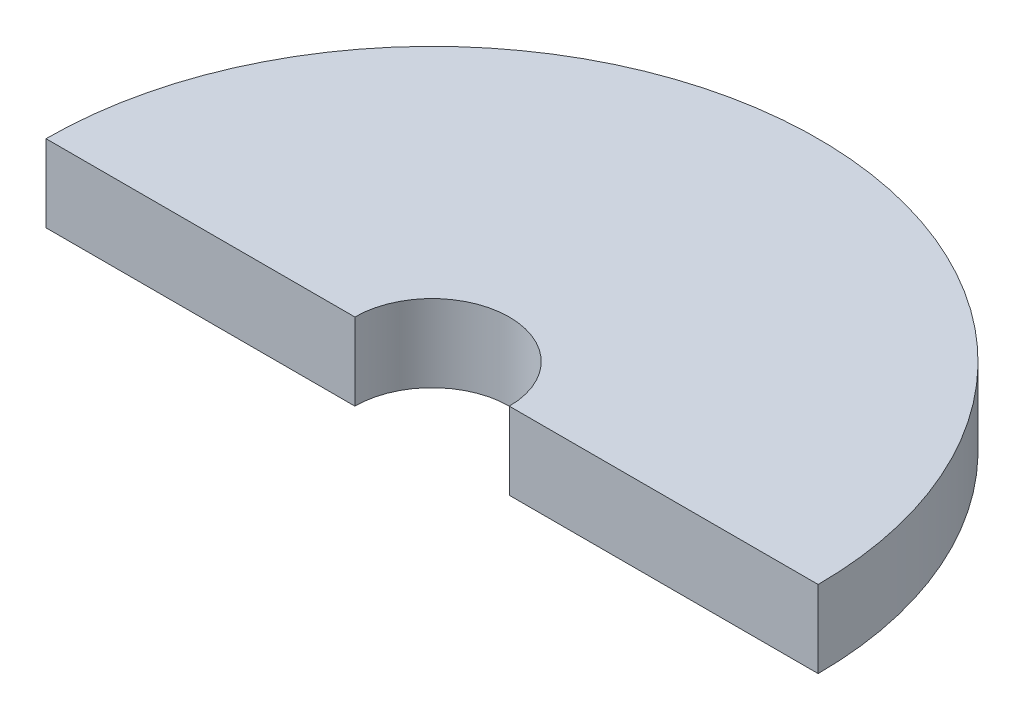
SolidWorks part; units mm, degrees
ref_plane "Face" through (0, 0, 0) normal (0, 0, 1) x (1, 0, 0)
ref_plane "Dessus" through (0, 0, 0) normal (0, 1, 0) x (1, 0, 0)
ref_plane "Droite" through (0, 0, 0) normal (1, 0, 0) x (0, 0, -1)
sketch "Esquisse1" plane through (0, 0, 0) normal (0, 1, 0) x (1, 0, 0)
  circle A0 centre (0, 0) radius 5
  circle A1 centre (0, 0) radius 1
  dimension "D1" = 10
  dimension "D2" = 2
extrude "Extrusion1" add sketch "Esquisse1" along normal blind 1
sketch "Esquisse2" plane through (0, 0, 0) normal (0, 0, 1) x (1, 0, 0)
  line L0 (0, 4.6708) -> (0, 1) construction
  line L1 (0, 0) -> (5, 0)
  line L2 (0, 0) -> (0, 1)
  line L3 (0, 1) -> (5, 1)
  line L4 (5, 0) -> (5, 1)
  line L6 (-5, 0) -> (5, 0) construction
  line L7 (5, 1) -> (-5, 1) construction
revolve "Coupe" cut sketch "Esquisse2" angle 180 about L0
